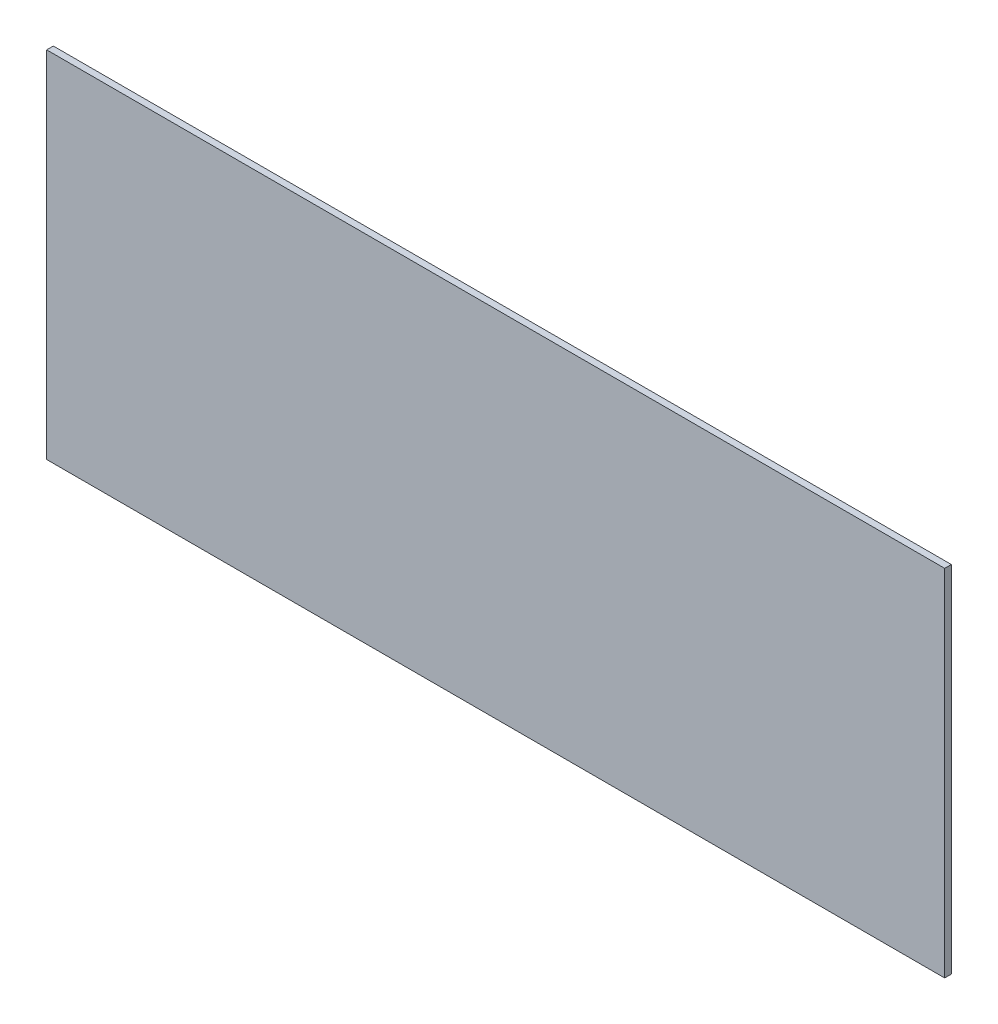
SolidWorks part; units mm, degrees
ref_plane "Alzado" through (0, 0, 0) normal (0, 0, 1) x (1, 0, 0)
ref_plane "Planta" through (0, 0, 0) normal (0, 1, 0) x (1, 0, 0)
ref_plane "Vista lateral" through (0, 0, 0) normal (1, 0, 0) x (0, 0, -1)
sketch "Croquis1" plane through (0, 0, 0) normal (0, 0, 1) x (1, 0, 0)
  line L1 (-202.5, -80) -> (202.5, -80)
  line L2 (-202.5, -80) -> (-202.5, 80)
  line L3 (-202.5, 80) -> (202.5, 80)
  line L4 (202.5, -80) -> (202.5, 80)
  line L5 (-202.5, -80) -> (202.5, 80) construction
  line L6 (-202.5, 80) -> (202.5, -80) construction
  point P0 (0, 0)
  dimension "D1" = 405
  dimension "D2" = 160
extrude "Saliente-Extruir1" add sketch "Croquis1" along normal blind 3
